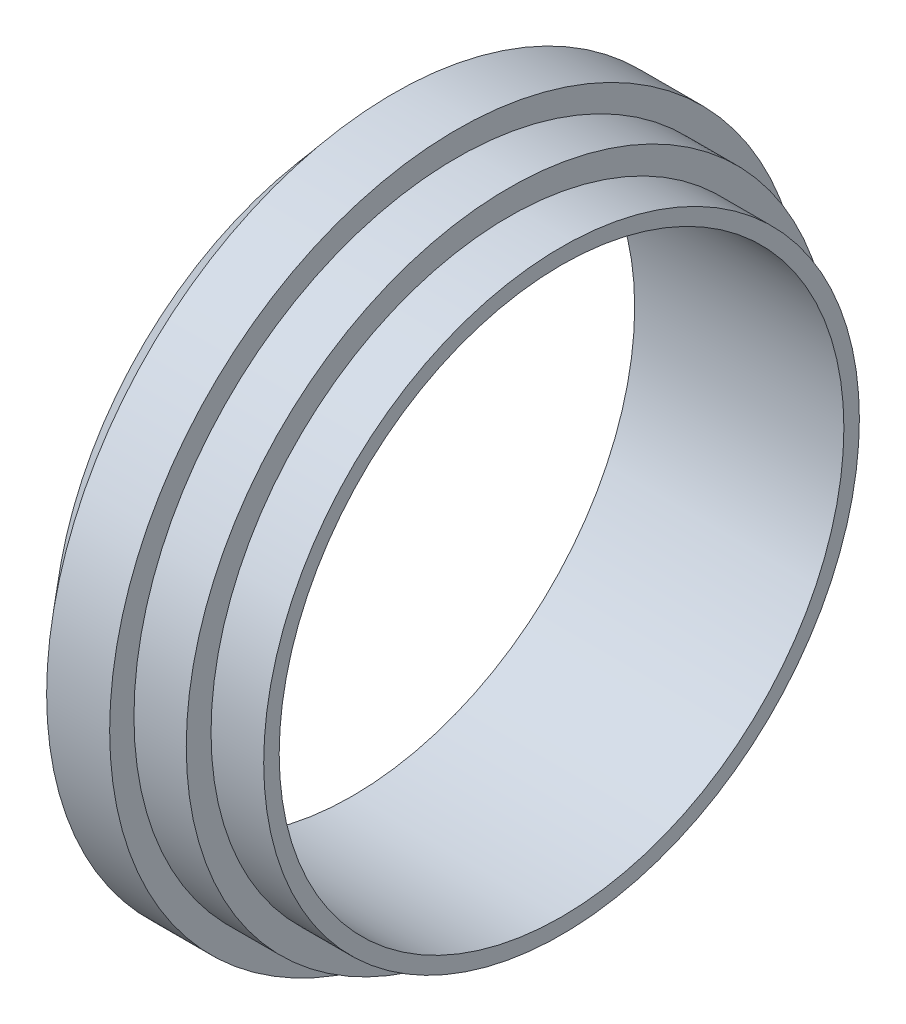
SolidWorks part; units mm, degrees
ref_plane "Front Plane" through (0, 0, 0) normal (0, 0, 1) x (1, 0, 0)
ref_plane "Top Plane" through (0, 0, 0) normal (0, 1, 0) x (1, 0, 0)
ref_plane "Right Plane" through (0, 0, 0) normal (1, 0, 0) x (0, 0, -1)
sketch "Sketch1" plane through (0, 0, 0) normal (0, 0, 1) x (1, 0, 0)
  line L0 (0, 0) -> (-5.6134, 0)
  line L1 (-5.6134, 0) -> (-5.6134, -2.6416)
  line L2 (-5.6134, -2.6416) -> (-11.1887, -2.6416)
  line L3 (-11.1887, -2.6416) -> (-11.1887, -5.2324)
  line L4 (-11.1887, -5.2324) -> (-17.907, -5.2324)
  line L5 (-17.907, -5.2324) -> (-22.3012, -0.0762)
  line L6 (-22.3012, -0.0762) -> (-22.3012, 31.75)
  line L7 (-22.3012, 31.75) -> (0, 31.75)
  line L8 (0, 31.75) -> (0, 0)
  dimension "D1" = 31.75
  dimension "D2" = 4.3942
  dimension "D3" = 11.1125
  dimension "D4" = 16.6878
  dimension "D5" = 22.3012
  dimension "D6" = 31.8262
  dimension "D7" = 36.9824
  dimension "D8" = 34.3916
revolve "Revolve1" add sketch "Sketch1" angle 360 about L7
sketch "Sketch4" plane through (-22.3012, 0, 0) normal (-1, 0, 0) x (0, 0, 1)
  circle A0 centre (0, 31.75) radius 30.099
extrude "Cut-Extrude1" cut sketch "Sketch4" against normal through all contours A0
